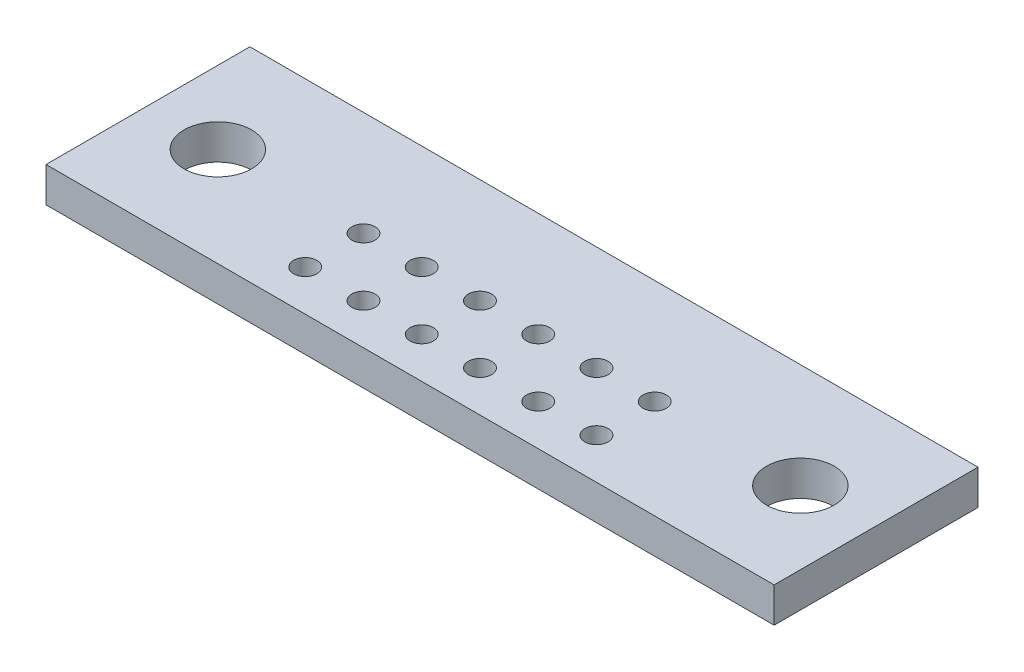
SolidWorks part; units mm, degrees
ref_plane "Front Plane" through (0, 0, 0) normal (0, 0, 1) x (1, 0, 0)
ref_plane "Top Plane" through (0, 0, 0) normal (0, 1, 0) x (1, 0, 0)
ref_plane "Right Plane" through (0, 0, 0) normal (1, 0, 0) x (0, 0, -1)
sketch "Sketch1" plane through (0, 0, 0) normal (0, 1, 0) x (1, 0, 0)
  line L0 (15.875, 0) -> (15.875, 8.89) construction
  line L1 (0, 0) -> (31.75, 0)
  line L2 (0, 0) -> (0, 8.89)
  line L3 (0, 8.89) -> (31.75, 8.89)
  line L4 (31.75, 0) -> (31.75, 8.89)
  circle A0 centre (17.145, 4.318) radius 0.508
  circle A1 centre (19.685, 4.318) radius 0.508
  circle A2 centre (22.225, 4.318) radius 0.508
  circle A3 centre (9.525, 4.318) radius 0.508
  circle A4 centre (12.065, 4.318) radius 0.508
  circle A5 centre (14.605, 4.318) radius 0.508
  circle A6 centre (14.605, 1.778) radius 0.508
  circle A7 centre (12.065, 1.778) radius 0.508
  circle A8 centre (9.525, 1.778) radius 0.508
  circle A9 centre (22.225, 1.778) radius 0.508
  circle A10 centre (19.685, 1.778) radius 0.508
  circle A11 centre (17.145, 1.778) radius 0.508
  circle A12 centre (28.575, 4.318) radius 1.4732
  circle A13 centre (3.175, 4.318) radius 1.4732
extrude "Extrude1" add sketch "Sketch1" along normal blind 1.524
